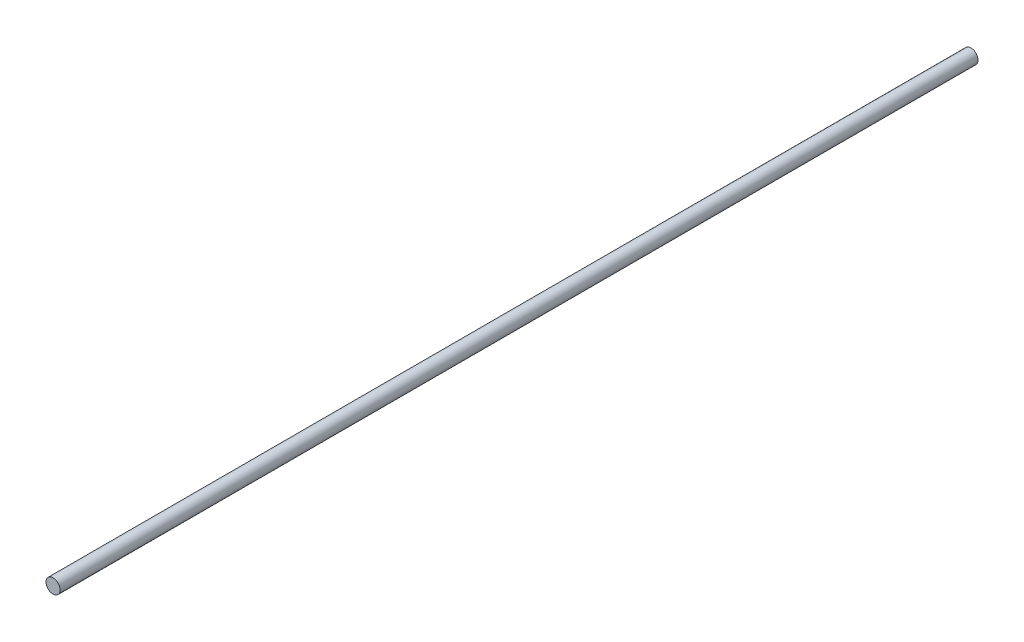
SolidWorks part; units mm, degrees
ref_plane "Front Plane" through (0, 0, 0) normal (0, 0, 1) x (1, 0, 0)
ref_plane "Top Plane" through (0, 0, 0) normal (0, 1, 0) x (1, 0, 0)
ref_plane "Right Plane" through (0, 0, 0) normal (1, 0, 0) x (0, 0, -1)
sketch "Sketch1" plane through (0, 0, 0) normal (0, 0, 1) x (1, 0, 0)
  circle A0 centre (0, 0) radius 30
  dimension "D1" = 60
extrude "Boss-Extrude1" add sketch "Sketch1" against normal blind 3900
